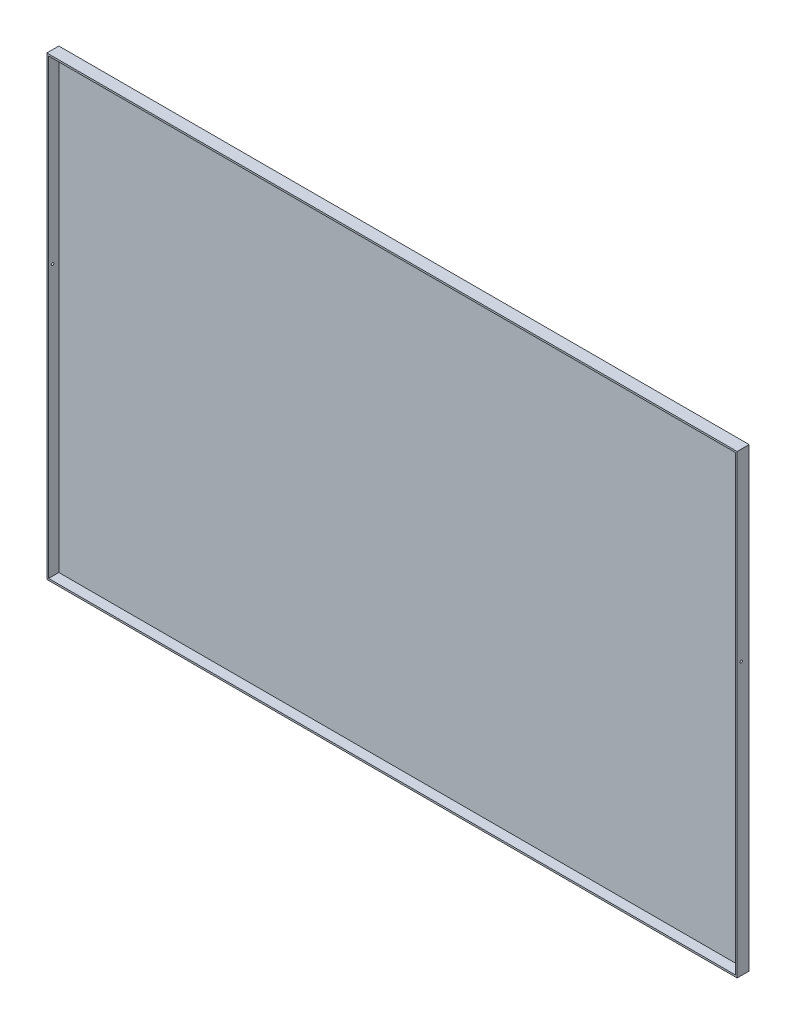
SolidWorks part; units mm, degrees
ref_plane "Plan de face" through (0, 0, 0) normal (0, 0, 1) x (1, 0, 0)
ref_plane "Plan de dessus" through (0, 0, 0) normal (0, 1, 0) x (1, 0, 0)
ref_plane "Plan de droite" through (0, 0, 0) normal (1, 0, 0) x (0, 0, -1)
sketch "Esquisse2" plane through (0, 0, 0) normal (0, 0, 1) x (1, 0, 0)
  line L1 (863, -570) -> (-863, -570)
  line L2 (863, -570) -> (863, 570)
  line L3 (863, 570) -> (-863, 570)
  line L4 (-863, -570) -> (-863, 570)
  line L5 (863, -570) -> (-863, 570) construction
  line L6 (863, 570) -> (-863, -570) construction
  point P0 (0, 0)
  dimension "D1" = 1726
  dimension "D2" = 1140
extrude "Boss.-Extru.1" add sketch "Esquisse2" along normal blind 30
shell "Coque1" thickness 4.4
sketch "Esquisse3" plane through (-863, 0, 0) normal (-1, 0, 0) x (0, 0, 1)
  line L0 (30, 570) -> (30, -570) construction
  line L1 (30, 570) -> (0, 570) construction
  circle A0 centre (20, 110) radius 3
  dimension "D1" = 10
  dimension "D2" = 460
  dimension "D3" = 6
extrude "Enlèv. mat.-Extru.1" cut sketch "Esquisse3" against normal through all
